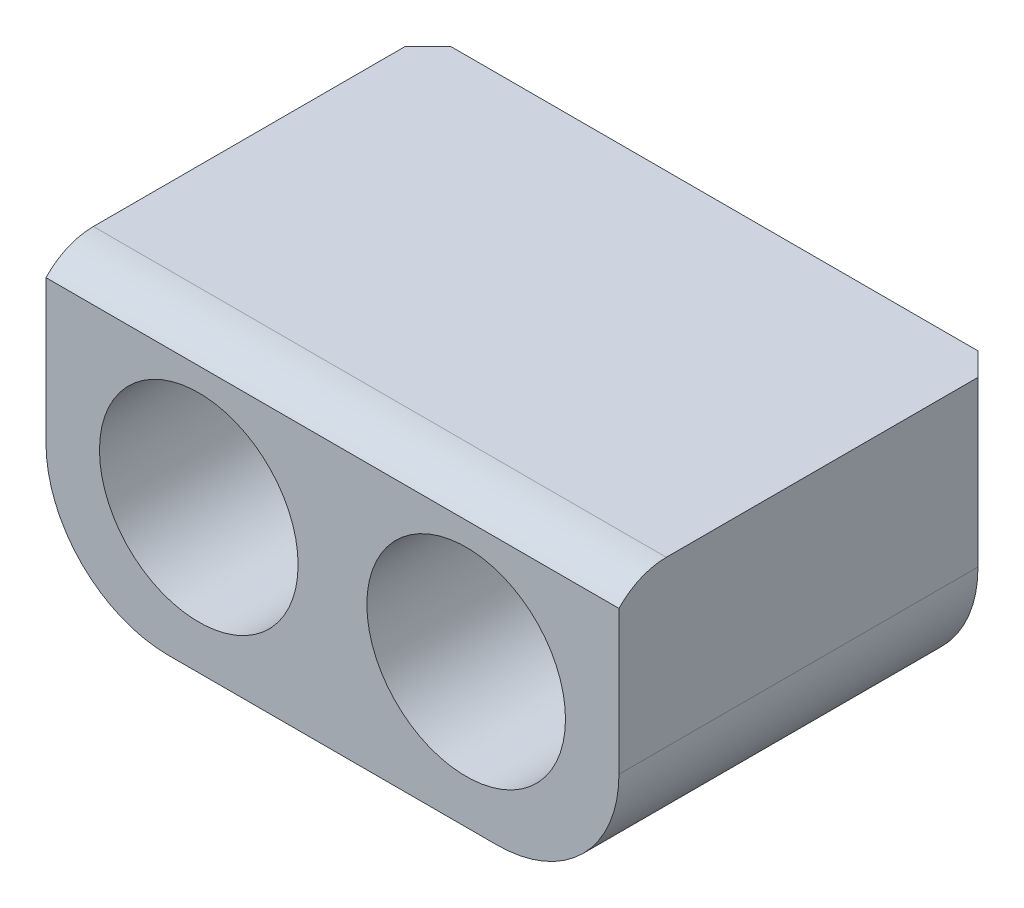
SolidWorks part; units mm, degrees
ref_plane "Front Plane" through (0, 0, 0) normal (0, 0, 1) x (1, 0, 0)
ref_plane "Top Plane" through (0, 0, 0) normal (0, 1, 0) x (1, 0, 0)
ref_plane "Right Plane" through (0, 0, 0) normal (1, 0, 0) x (0, 0, -1)
sketch "Sketch3" plane through (0, 0, 0) normal (0, 0, 1) x (1, 0, 0)
  line L0 (0, -5.2388) -> (0, 5.2388) construction
  line L1 (0, 0) -> (19.05, 0)
  line L2 (0, 0) -> (0, -9.525)
  line L3 (0, -9.525) -> (19.05, -9.525)
  line L4 (19.05, 0) -> (19.05, -9.525)
  dimension "D1" = 9.525
  dimension "D2" = 19.05
extrude "Extrude1" add sketch "Sketch3" against normal blind 12.7
fillet "Fillet1" radius 4.064 2 edges at (19.05, -9.525, -6.35) (0, -9.525, -6.35)
hole_wizard "#6 CBORE" positions "Sketch5" profile "Sketch4" counterbore size "#10" standard "ANSI Inch"
sketch "Sketch5" plane through (0, 0, 0) normal (0, 0, 1) x (1, 0, 0)
  line L0 (-1.269, -4.7625) -> (49998.731, -4.7625) construction
  line L1 (19.05, 0) -> (0, 0) construction
  line L2 (4.064, -9.525) -> (14.986, -9.525) construction
  line L3 (0, 0) -> (0, -5.461) construction
  point P0 (5.08, -4.7625)
  point P1 (13.97, -4.7625)
  dimension "D1" = 5.08
  dimension "D2" = 13.97
sketch "Sketch4" plane through (5.08, -4.7625, 0) normal (1, 0, 0) x (0, -1, 0)
  line L0 (0, 0) -> (0, 12.7)
  line L1 (0, 12.7) -> (2.159, 12.7)
  line L3 (2.159, 12.7) -> (2.159, 4.826)
  line L4 (2.159, 4.826) -> (3.302, 4.826)
  line L5 (3.302, 4.826) -> (3.302, 0)
  line L7 (3.302, 0) -> (0, 0)
  line L11 (0, -6.35) -> (0, 107.95) construction
  dimension "Thru Hole Dia." = 4.318
  dimension "Thru Hole Depth" = 12.7
  dimension "C'Bore Dia." = 6.604
  dimension "C'Bore Depth" = 4.826
sketch "Sketch6" plane through (0, 0, 0) normal (-1, 0, 0) x (0, 0, 1)
  line L0 (0, -0.6851) -> (0.9652, -0.6851)
  line L1 (-1.5748, 0) -> (-1.5748, 0.5849)
  line L3 (-12.7, 0) -> (0, 0) construction
  line L4 (0.9652, -0.6851) -> (0.9652, 0.5849)
  line L5 (0.9652, 0.5849) -> (-1.5748, 0.5849)
  arc A0 (-1.5748, 0) -> (0, -0.6851) centre (-1.5748, -2.1525) cw
  dimension "D4" = 1.27
  dimension "D5" = 2.54
extrude "Cut-Extrude1" cut sketch "Sketch6" against normal through all
chamfer "Chamfer1" distance 0.762 angle 45 5 edges at (9.525, -9.525, -12.7) (17.8597, -8.3347, -12.7) (19.05, -2.7305, -12.7) (0, -2.7305, -12.7) (1.1903, -8.3347, -12.7)
